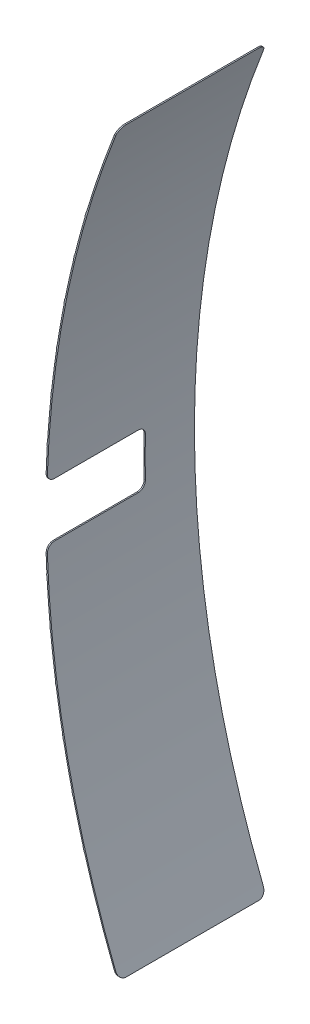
SolidWorks part; units mm, degrees
ref_plane "前视基准面" through (0, 0, 0) normal (0, 0, 1) x (1, 0, 0)
ref_plane "上视基准面" through (0, 0, 0) normal (0, 1, 0) x (1, 0, 0)
ref_plane "右视基准面" through (0, 0, 0) normal (1, 0, 0) x (0, 0, -1)
sketch "草图1" plane through (0, 0, 0) normal (0, 0, 1) x (1, 0, 0)
  line L0 (-37.1349, 15) -> (-37.081, 15)
  line L1 (-37.1349, -15) -> (-37.081, -15)
  line L2 (-1000, 0) -> (49000, 0) construction
  arc A0 (-37.1349, 15) -> (-37.1349, -15) centre (0, 0) ccw
  arc A1 (-37.081, 15) -> (-37.081, -15) centre (0, 0) ccw
  dimension "D1" = 80.1
  dimension "D2" = 80
  dimension "D3" = 30
extrude "凸台-拉伸1" add sketch "草图1" along normal blind 6
ref_plane "基准面1" through (-50, 0, 0) normal (1, 0, 0) x (0, 0, -1)
sketch "草图4" plane through (0, 0, 0) normal (1, 0, 0) x (0, 0, -1)
  line L0 (-6, -1.1) -> (-2, -1.1)
  line L1 (-6, 15) -> (-6, -15) construction
  line L2 (-2, -1.1) -> (-2, 1.1)
  line L3 (-2, 1.1) -> (-6, 1.1)
  line L4 (-6, 1.1) -> (-6, -1.1)
  line L5 (-1000, 0) -> (49000, 0) construction
  dimension "D1" = 4
  dimension "D2" = 2.2
extrude "切除-拉伸1" cut sketch "草图4" against normal through all
fillet "圆角1" radius 0.3 8 edges at (-37.108, -15, 6) (-37.108, -15, 0) (-37.108, 15, 6) (-37.108, 15, 0) (-40.0099, -1.1, 2) (-40.0099, 1.1, 2) (-40.0099, 1.1, 6) (-40.0099, -1.1, 6)
sketch "草图5" plane through (-50, 0, 0) normal (1, 0, 0) x (0, 0, -1)
  line L0 (0, -2.8572) -> (0, 3.1428)
  line L1 (0, 3.1428) -> (-2, 0.1428)
  line L2 (-2, 0.1428) -> (0, -2.8572)
  line L3 (-1002, 0.1428) -> (48998, 0.1428) construction
  line L4 (0, -14.7) -> (0, 14.7) construction
  line L5 (-2, 0.8) -> (-2, -0.8) construction
  line L6 (-6, -1.4) -> (-6, -14.7) construction
  line L7 (-6, -2.3) -> (-2, -2.3)
  line L8 (-6, -2.3) -> (-6, -2.1)
  line L9 (-6, -2.1) -> (-2, -2.1)
  line L10 (-2, -2.3) -> (-2, -2.1)
  line L31 (-5.7, -1.1) -> (-2.3, -1.1) construction
  line L56 (-6, -4.1) -> (-2, -4.1)
  line L57 (-6, -4.1) -> (-6, -3.9)
  line L58 (-6, -3.9) -> (-2, -3.9)
  line L59 (-2, -4.1) -> (-2, -3.9)
  line L60 (-6, -5.9) -> (-2, -5.9)
  line L61 (-6, -5.9) -> (-6, -5.7)
  line L62 (-6, -5.7) -> (-2, -5.7)
  line L63 (-2, -5.9) -> (-2, -5.7)
  line L64 (-6, -7.7) -> (-2, -7.7)
  line L65 (-6, -7.7) -> (-6, -7.5)
  line L66 (-6, -7.5) -> (-2, -7.5)
  line L67 (-2, -7.7) -> (-2, -7.5)
  line L68 (-6, -9.5) -> (-2, -9.5)
  line L69 (-6, -9.5) -> (-6, -9.3)
  line L70 (-6, -9.3) -> (-2, -9.3)
  line L71 (-2, -9.5) -> (-2, -9.3)
  line L72 (-6, -11.3) -> (-2, -11.3)
  line L73 (-6, -11.3) -> (-6, -11.1)
  line L74 (-6, -11.1) -> (-2, -11.1)
  line L75 (-2, -11.3) -> (-2, -11.1)
  line L76 (-6, -2.3) -> (-6, -4.1) construction
  line L77 (-6, 2.5855) -> (-6, 4.3855) construction
  line L78 (-2, 11.5855) -> (-2, 11.3855)
  line L79 (-6, 11.3855) -> (-2, 11.3855)
  line L80 (-6, 11.5855) -> (-6, 11.3855)
  line L81 (-6, 11.5855) -> (-2, 11.5855)
  line L82 (-2, 9.7855) -> (-2, 9.5855)
  line L83 (-6, 9.5855) -> (-2, 9.5855)
  line L84 (-6, 9.7855) -> (-6, 9.5855)
  line L85 (-6, 9.7855) -> (-2, 9.7855)
  line L86 (-2, 7.9855) -> (-2, 7.7855)
  line L87 (-6, 7.7855) -> (-2, 7.7855)
  line L88 (-6, 7.9855) -> (-6, 7.7855)
  line L89 (-6, 7.9855) -> (-2, 7.9855)
  line L90 (-2, 6.1855) -> (-2, 5.9855)
  line L91 (-6, 5.9855) -> (-2, 5.9855)
  line L92 (-6, 6.1855) -> (-6, 5.9855)
  line L93 (-6, 6.1855) -> (-2, 6.1855)
  line L94 (-2, 4.3855) -> (-2, 4.1855)
  line L95 (-6, 4.1855) -> (-2, 4.1855)
  line L96 (-6, 4.3855) -> (-6, 4.1855)
  line L97 (-6, 4.3855) -> (-2, 4.3855)
  line L98 (-2, 2.5855) -> (-2, 2.3855)
  line L99 (-6, 2.3855) -> (-2, 2.3855)
  line L100 (-6, 2.5855) -> (-6, 2.3855)
  line L101 (-6, 2.5855) -> (-2, 2.5855)
  line L116 (-5.7, 15) -> (-0.3, 15) construction
  line L117 (-4.8, 13.5) -> (-3.65, 13.5)
  line L118 (-4.8, 13.5) -> (-4.8, 13.3)
  line L119 (-4.8, 13.3) -> (-3.65, 13.3)
  line L120 (-2.3, 13.5) -> (-2.3, 13.3)
  line L121 (-6, 14.7) -> (-6, 1.4) construction
  line L122 (-3.65, 14.65) -> (-3.45, 14.65)
  line L123 (-3.65, 14.65) -> (-3.65, 13.5)
  line L124 (-3.65, 12.15) -> (-3.45, 12.15)
  line L125 (-3.45, 14.65) -> (-3.45, 13.5)
  line L126 (-5.7, -15) -> (-0.3, -15) construction
  line L127 (-3.65, -12.15) -> (-3.45, -12.15)
  line L128 (-3.65, -12.15) -> (-3.65, -14.65)
  line L129 (-3.65, -14.65) -> (-3.45, -14.65)
  line L130 (-3.45, -12.15) -> (-3.45, -14.65)
  line L131 (-3.45, 13.3) -> (-3.45, 12.15)
  line L132 (-3.45, 13.5) -> (-2.3, 13.5)
  line L133 (-3.65, 13.3) -> (-3.65, 12.15)
  line L134 (-3.45, 13.3) -> (-2.3, 13.3)
  point P81 (-3.65, -13.4)
  dimension "D1" = 6
  dimension "D2" = 0.2
  dimension "D3" = 6
  dimension "D5" = 1
  dimension "D4" = 1.8
  dimension "D6" = 2.5
  dimension "D7" = 0.2
  dimension "D8" = 1.5
  dimension "D9" = 2.5
  dimension "D10" = 0.2
  dimension "D11" = 1.15
  dimension "D12" = 1.15
  dimension "D13" = 1.2
  dimension "D14" = 2.5
  dimension "D15" = 0.2
  dimension "D16" = 0.35
  dimension "D17" = 2.35
wrap "包覆1" sketch "草图5" wrap type emboss source sketch "草图5" thickness 0.01 parameters "D1"=0.01
